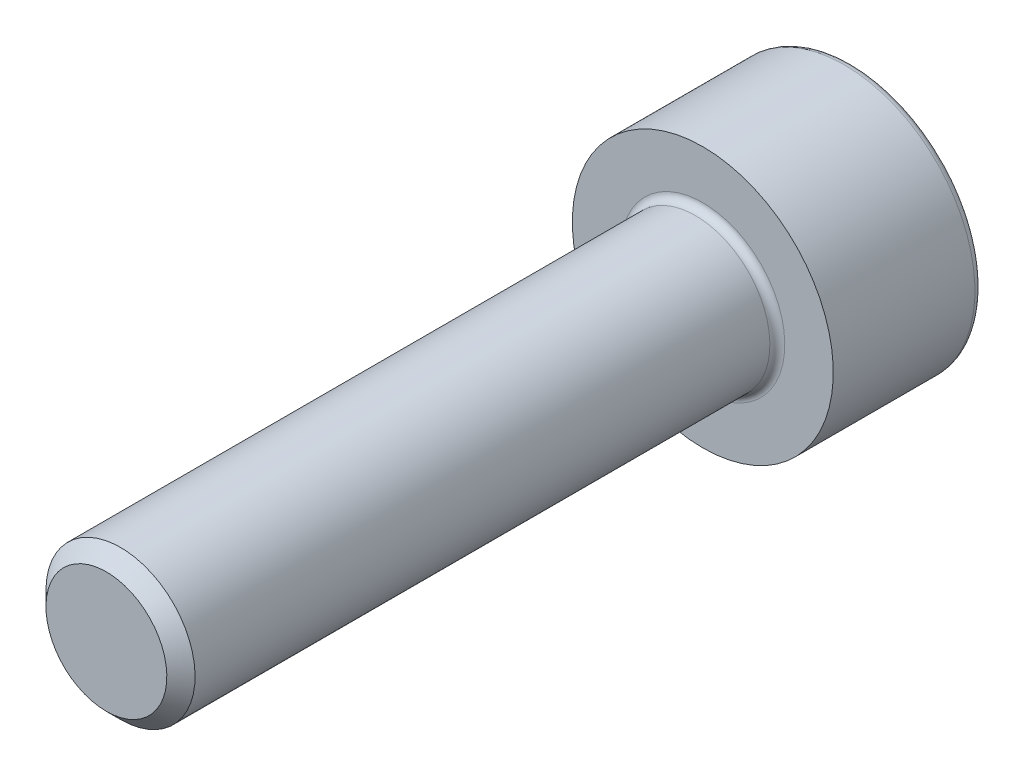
SolidWorks part; units mm, degrees
ref_plane "Plan1" through (0, 0, 0) normal (0, 0, 1) x (1, 0, 0)
ref_plane "Plan2" through (0, 0, 0) normal (0, 1, 0) x (1, 0, 0)
ref_plane "Plan3" through (0, 0, 0) normal (1, 0, 0) x (0, 0, -1)
sketch "Sketch1" plane through (0, 0, 0) normal (1, 0, 0) x (0, 0, -1)
  line L0 (4, 0) -> (-16, 0) construction
  line L1 (4, 0) -> (4, 3.5)
  line L2 (4, 3.5) -> (0, 3.5)
  line L3 (0, 3.5) -> (0, 2)
  line L4 (0, 2) -> (-16, 2)
  line L5 (-16, 2) -> (-16, 0)
  line L6 (-16, 0) -> (4, 0)
  line L7 (4, 0) -> (3.3, 0) construction
  dimension "DK" = 7
  dimension "L" = 16
  dimension "K" = 4
  dimension "D" = 4
  dimension "P" = 0.7
revolve "Base-Revolve" add sketch "Sketch1"
chamfer "Chamfer1" distance 0.3789 angle 45
fillet "Fillet1" radius 0.2
hole_wizard "Hole1" positions "Sketch3" profile "Sketch2" legacy
sketch "Sketch3" plane through (0, 0, -4) normal (0, 0, -1) x (-1, 0, 0)
  circle A0 centre (0, 0) radius 3.5 construction
  point P0 (0, 0)
sketch "Sketch2" plane through (0, 0, -4) normal (1, 0, 0) x (0, 1, 0)
  line L0 (0, 0) -> (0, 2.866)
  line L1 (0, 2.866) -> (1.5, 2)
  line L2 (1.5, 2) -> (1.5, 0)
  line L4 (1.5, 0) -> (0, 0)
  line L6 (0, 2.866) -> (-1.5, 2) construction
  line L7 (0, -4.2442) -> (0, 117.3081) construction
  dimension "Diameter" = 3
  dimension "Depth" = 2
  dimension "Drill Angle" = 120
sketch "Sketch4" plane through (0, 0, -4) normal (0, 0, -1) x (-1, 0, 0)
  line L0 (0, -1.5) -> (0, 1.5) construction
  line L1 (1.7321, 0) -> (-1.7321, 0) construction
  line L2 (0.866, 1.5) -> (-0.866, 1.5)
  line L3 (-0.866, 1.5) -> (-1.7321, 0)
  line L4 (-1.7321, 0) -> (-0.866, -1.5)
  line L5 (-0.866, -1.5) -> (0.866, -1.5)
  line L6 (0.866, -1.5) -> (1.7321, 0)
  line L7 (1.7321, 0) -> (0.866, 1.5)
  dimension "D1" = 120
  dimension "S" = 3
extrude "Cut-Extrude1" cut sketch "Sketch4" against normal blind 2
equation "\"K@Sketch1\" = \"D@Sketch1\""
equation "\"D1@Fillet1\" = \"D@Sketch1\"*0.05"
equation "\"S@Sketch4\" = \"Diameter@Sketch2\""
equation "\"T@Cut-Extrude1\" = \"Depth@Sketch2\""
equation "\"D1@Cosmetic_Thread1\" = \"D@Sketch1\"-(1.0825*\"P@Sketch1\")"
equation "\"D1@Chamfer1\" = (\"D@Sketch1\"-\"D1@Cosmetic_Thread1\")/2"
